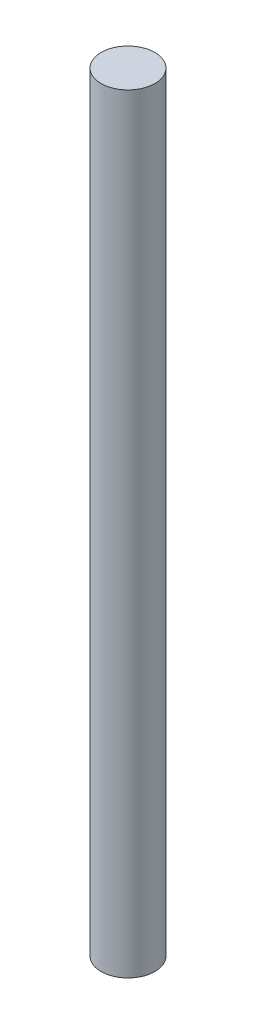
SolidWorks part; units mm, degrees
ref_plane "Front Plane" through (0, 0, 0) normal (0, 0, 1) x (1, 0, 0)
ref_plane "Top Plane" through (0, 0, 0) normal (0, 1, 0) x (1, 0, 0)
ref_plane "Right Plane" through (0, 0, 0) normal (1, 0, 0) x (0, 0, -1)
sketch "Sketch1" plane through (0, 0, 0) normal (0, 1, 0) x (1, 0, 0)
  circle A0 centre (0, 0) radius 4
  dimension "D1" = 8
extrude "Boss-Extrude1" add sketch "Sketch1" along normal blind 114.3 contours A0
